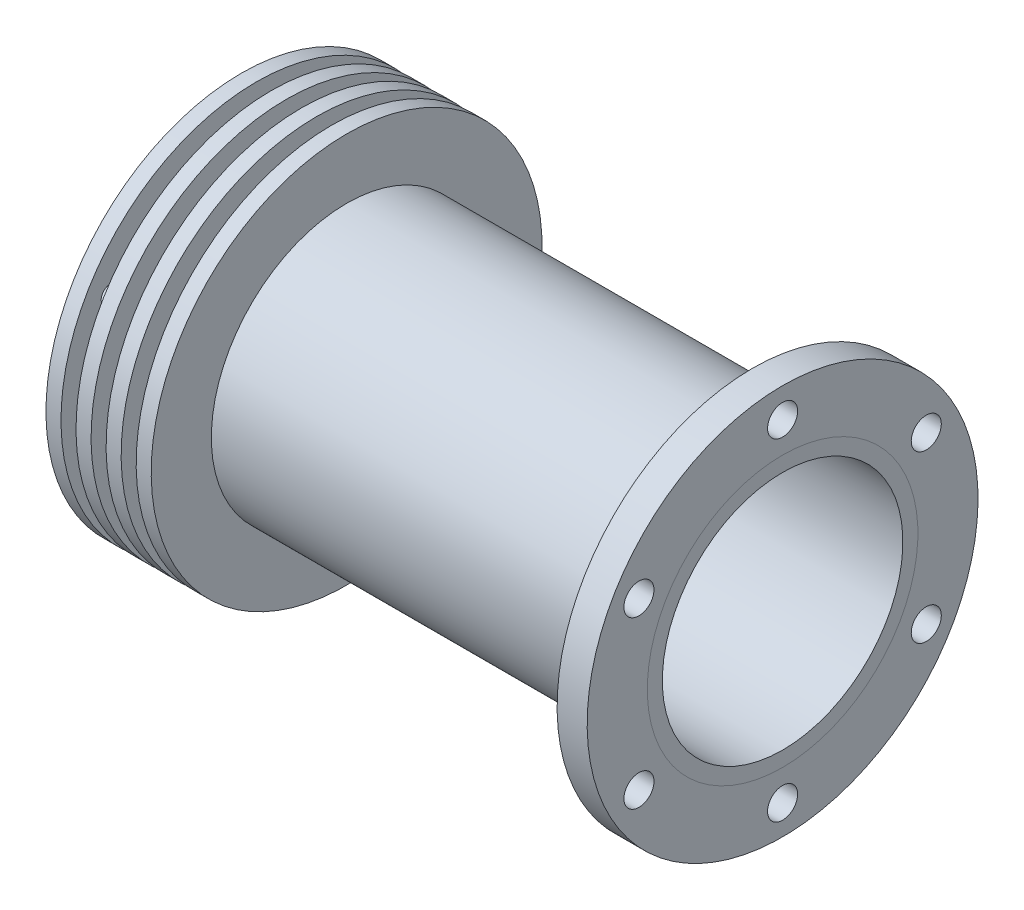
SolidWorks part; units mm, degrees
ref_plane "Front Plane" through (0, 0, 0) normal (0, 0, 1) x (1, 0, 0)
ref_plane "Top Plane" through (0, 0, 0) normal (0, 1, 0) x (1, 0, 0)
ref_plane "Right Plane" through (0, 0, 0) normal (1, 0, 0) x (0, 0, -1)
sketch "Sketch1" plane through (0, 0, 0) normal (0, 0, 1) x (1, 0, 0)
  line L0 (18.0428, -23.876) -> (18.0428, 17.399)
  line L1 (18.0428, 17.399) -> (21.2178, 17.399)
  line L2 (21.2178, 17.399) -> (21.2178, 4.699)
  line L3 (21.2178, 4.699) -> (24.3928, 4.699)
  line L4 (24.3928, 4.699) -> (24.3928, 17.399)
  line L5 (24.3928, 17.399) -> (27.5678, 17.399)
  line L6 (27.5678, 17.399) -> (27.5678, 4.699)
  line L7 (27.5678, 4.699) -> (30.7428, 4.699)
  line L8 (30.7428, 4.699) -> (30.7428, 17.399)
  line L9 (30.7428, 17.399) -> (33.9178, 17.399)
  line L10 (33.9178, 17.399) -> (33.9178, 4.699)
  line L11 (33.9178, 4.699) -> (37.0928, 4.699)
  line L12 (37.0928, 4.699) -> (37.0928, 17.399)
  line L13 (37.0928, 17.399) -> (40.2678, 17.399)
  line L14 (40.2678, 17.399) -> (40.2678, 4.699)
  line L15 (40.2678, 4.699) -> (125.9928, 4.699)
  line L16 (132.3428, -23.876) -> (18.0428, -23.876)
  line L17 (132.3428, 4.699) -> (132.3428, -23.876)
  line L18 (125.9928, 4.699) -> (125.9928, 17.399)
  line L19 (125.9928, 17.399) -> (132.3428, 17.399)
  line L20 (132.3428, 17.399) -> (132.3428, 4.699)
  dimension "D1" = 41.275
  dimension "D2" = 12.7
  dimension "D3" = 28.575
  dimension "D4" = 114.3
  dimension "D5" = 3.175
  dimension "D6" = 3.175
  dimension "D7" = 3.175
  dimension "D8" = 3.175
  dimension "D9" = 3.175
  dimension "D10" = 3.175
  dimension "D11" = 3.175
  dimension "D12" = 6.35
  dimension "D14" = 92.075
revolve "Revolve7" add sketch "Sketch1" angle 360 about L16
sketch "Sketch3" plane through (18.0428, 0, 0) normal (-1, 0, 0) x (0, 0, 1)
  circle A0 centre (0, -23.876) radius 12.7
  circle A1 centre (0, -23.876) radius 28.575 construction
  dimension "D1" = 25.4
extrude "Cut-Extrude3" cut sketch "Sketch3" against normal through all
sketch "Sketch5" plane through (18.0428, 0, 0) normal (-1, 0, 0) x (0, 0, 1)
  circle A0 centre (0, -23.876) radius 25.4
  circle A1 centre (0, -23.876) radius 41.275 construction
  dimension "D1" = 50.8
extrude "Cut-Extrude4" cut sketch "Sketch5" against normal through all
sketch "Sketch7" plane through (132.3428, 0, 0) normal (1, 0, 0) x (0, 0, -1)
  circle A0 centre (0, 11.159) radius 3.175
  dimension "D1" = 6.35
extrude "Cut-Extrude5" cut sketch "Sketch7" against normal blind 6.35
pattern_circular "CirPattern1" count 6 over 360 about axis through (0, -23.876, 0) along (1, 0, 0) of "Cut-Extrude5"
sketch "Sketch8" plane through (18.0428, 0, 0) normal (-1, 0, 0) x (0, 0, 1)
  circle A0 centre (0, 11.6944) radius 1.9812
  dimension "D1" = 3.9624
extrude "Cut-Extrude6" cut sketch "Sketch8" against normal blind 6.604
pattern_circular "CirPattern2" count 6 over 360 about axis through (0, -23.876, 0) along (1, 0, 0) of "Cut-Extrude6"
